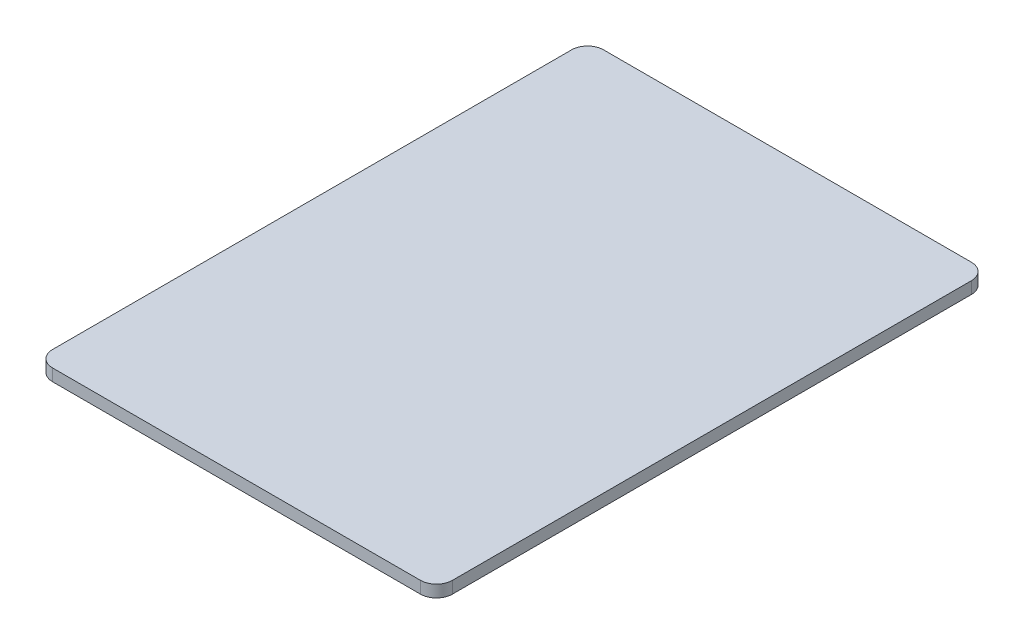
SolidWorks part; units mm, degrees
ref_plane "Front Plane" through (0, 0, 0) normal (0, 0, 1) x (1, 0, 0)
ref_plane "Top Plane" through (0, 0, 0) normal (0, 1, 0) x (1, 0, 0)
ref_plane "Right Plane" through (0, 0, 0) normal (1, 0, 0) x (0, 0, -1)
sketch "Sketch1" plane through (0, 0, 0) normal (0, 1, 0) x (1, 0, 0)
  line L1 (0, 0) -> (254, 0)
  line L2 (0, 0) -> (0, 350.012)
  line L3 (0, 350.012) -> (254, 350.012)
  line L4 (254, 0) -> (254, 350.012)
  dimension "D1" = 254
  dimension "D2" = 350.012
extrude "Boss-Extrude1" add sketch "Sketch1" along normal blind 7.62
fillet "Fillet1" radius 10.16 4 edges at (0, 3.81, -350.012) (0, 3.81, 0) (254, 3.81, -350.012) (254, 3.81, 0)
sketch "Sketch2" plane through (0, 0, 0) normal (-1, 0, 0) x (0, 0, 1)
  line L0 (-200.406, 0) -> (-149.606, 0) construction
  line L1 (-339.852, 0) -> (-10.16, 0) construction
  line L2 (-200.406, 5.08) -> (-149.606, 5.08)
  line L3 (-200.406, -5.08) -> (-149.606, -5.08)
  arc A0 (-200.406, 5.08) -> (-200.406, -5.08) centre (-200.406, 0) ccw
  arc A1 (-149.606, -5.08) -> (-149.606, 5.08) centre (-149.606, 0) ccw
  point P4 (-175.006, 0)
  dimension "D2" = 5.08
  dimension "D1" = 50.8
extrude "Cut-Extrude1" cut sketch "Sketch2" against normal blind 7.62
